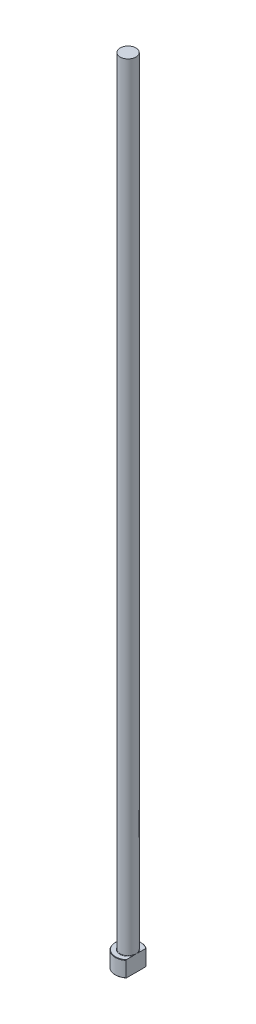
SolidWorks part; units mm, degrees
ref_plane "Front Plane" through (0, 0, 0) normal (0, 0, 1) x (1, 0, 0)
ref_plane "Top Plane" through (0, 0, 0) normal (0, 1, 0) x (1, 0, 0)
ref_plane "Right Plane" through (0, 0, 0) normal (1, 0, 0) x (0, 0, -1)
sketch "Sketch1" plane through (0, 0, 0) normal (0, 0, 1) x (1, 0, 0)
  line L0 (0, 259.9588) -> (0, -15.1925) construction
  line L1 (0, 0) -> (-6.5, 0)
  line L2 (-6.5, 0) -> (-6.5, 8)
  line L3 (-6.5, 8) -> (-4, 8)
  line L4 (-4, 8) -> (-4, 400)
  line L5 (-4, 400) -> (0, 400)
  line L6 (0, 400) -> (0, 0)
  dimension "L" = 400
  dimension "H" = 13
  dimension "T" = 8
  dimension "D" = 8
revolve "Revolve1" add sketch "Sketch1" angle 360 about L0
chamfer "Chamfer1" distance 0.2 angle 45 2 edges at (0, 8, 6.5) (0, 0, 6.5)
fillet "Fillet1" radius 0.2 1 edges at (0, 8, 4)
sketch "Sketch2" plane through (0, 0, 0) normal (0, 1, 0) x (1, 0, 0)
  line L0 (4, -5.1235) -> (4, 5.1235)
  circle A0 centre (0, 0) radius 6.5 construction
  arc A1 (4, -5.1235) -> (4, 5.1235) centre (0, 0) ccw
  circle A2 centre (0, 0) radius 4 construction
extrude "KEYED HEAD" cut sketch "Sketch2" along normal through all
